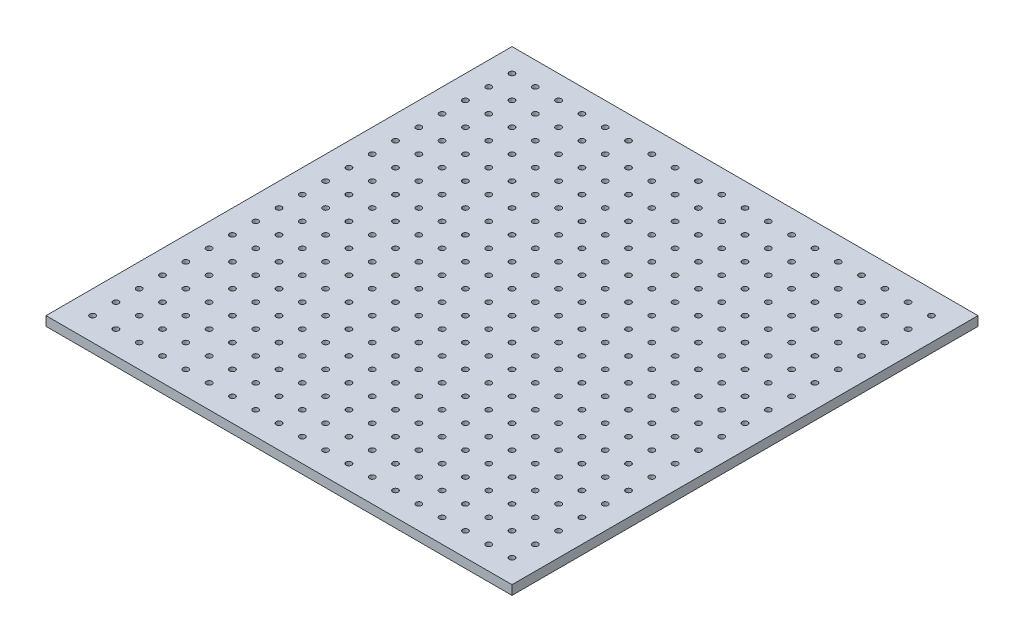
SolidWorks part; units mm, degrees
ref_plane "Front Plane" through (0, 0, 0) normal (0, 0, 1) x (1, 0, 0)
ref_plane "Top Plane" through (0, 0, 0) normal (0, 1, 0) x (1, 0, 0)
ref_plane "Right Plane" through (0, 0, 0) normal (1, 0, 0) x (0, 0, -1)
sketch "Sketch1" plane through (0, 0, 0) normal (0, 1, 0) x (1, 0, 0)
  line L1 (-250, -250) -> (250, -250)
  line L2 (-250, -250) -> (-250, 250)
  line L3 (-250, 250) -> (250, 250)
  line L4 (250, -250) -> (250, 250)
  line L5 (-250, -250) -> (250, 250) construction
  line L6 (-250, 250) -> (250, -250) construction
  point P0 (0, 0)
  dimension "D1" = 500
  dimension "D2" = 500
extrude "Boss-Extrude1" add sketch "Sketch1" along normal blind 10
sketch "Sketch2" plane through (0, 10, 0) normal (0, 1, 0) x (1, 0, 0)
  line L0 (-250, -225) -> (-225, -225) construction
  line L1 (-250, 250) -> (-250, -250) construction
  line L2 (-225, -225) -> (-225, -250) construction
  line L3 (-250, -250) -> (250, -250) construction
  circle A0 centre (-225, -225) radius 3
  dimension "D3" = 6
  dimension "D1" = 25
  dimension "D2" = 25
extrude "Cut-Extrude1" cut sketch "Sketch2" against normal through all
pattern_linear "LPattern1" count 19 spacing 25 along (0, 0, -1) of "Cut-Extrude1"
pattern_linear "LPattern2" count 19 spacing 25 along (1, 0, 0) of "LPattern1", "Cut-Extrude1"
